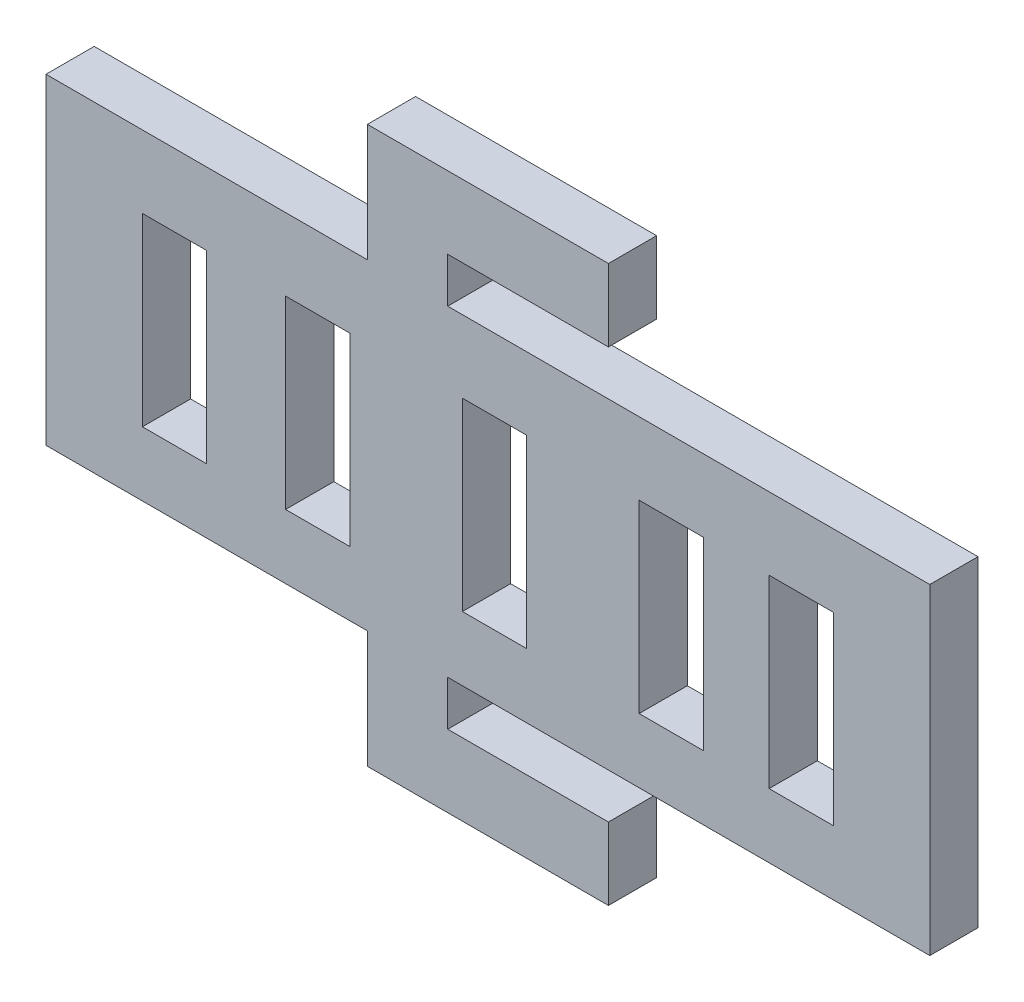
SolidWorks part; units mm, degrees
ref_plane "Alzado" through (0, 0, 0) normal (0, 0, 1) x (1, 0, 0)
ref_plane "Planta" through (0, 0, 0) normal (0, 1, 0) x (1, 0, 0)
ref_plane "Vista lateral" through (0, 0, 0) normal (1, 0, 0) x (0, 0, -1)
sketch "Sketch1" plane through (0, 0, 0) normal (0, 0, 1) x (1, 0, 0)
  line L0 (-7.5, -10) -> (-7.5, -17.3)
  line L1 (-27.5, -10) -> (27.5, -10)
  line L2 (-27.5, -10) -> (-27.5, 10)
  line L3 (-27.5, 10) -> (27.5, 10)
  line L4 (27.5, -10) -> (27.5, 10)
  line L5 (-27.5, -10) -> (27.5, 10) construction
  line L6 (-27.5, 10) -> (27.5, -10) construction
  line L7 (-7.5, -17.3) -> (7.5, -17.3)
  line L8 (7.5, -17.3) -> (7.5, -12.8)
  line L9 (7.5, -12.8) -> (-2.5, -12.8)
  line L10 (-2.5, -12.8) -> (-2.5, -10)
  line L11 (-7.5, 10) -> (-7.5, 17.3)
  line L12 (-7.5, 17.3) -> (7.5, 17.3)
  line L13 (7.5, 17.3) -> (7.5, 12.8)
  line L14 (7.5, 12.8) -> (-2.5, 12.8)
  line L15 (-2.5, 12.8) -> (-2.5, 10)
  line L17 (-17.5, -6) -> (-21.5, -6)
  line L18 (-17.5, -6) -> (-17.5, 5.5)
  line L19 (-17.5, 5.5) -> (-21.5, 5.5)
  line L20 (-21.5, -6) -> (-21.5, 5.5)
  line L21 (-17.5, -6) -> (-21.5, 5.5) construction
  line L22 (-17.5, 5.5) -> (-21.5, -6) construction
  line L23 (-12.5879, 5.5) -> (-8.5879, 5.5)
  line L24 (-12.5879, 5.5) -> (-12.5879, -6)
  line L25 (-12.5879, -6) -> (-8.5879, -6)
  line L26 (-8.5879, 5.5) -> (-8.5879, -6)
  line L27 (-1.5879, 5.5) -> (2.4121, 5.5)
  line L28 (-1.5879, 5.5) -> (-1.5879, -6)
  line L29 (-1.5879, -6) -> (2.4121, -6)
  line L30 (2.4121, 5.5) -> (2.4121, -6)
  line L31 (9.4121, 5.5) -> (13.4121, 5.5)
  line L32 (9.4121, 5.5) -> (9.4121, -6)
  line L33 (9.4121, -6) -> (13.4121, -6)
  line L34 (13.4121, 5.5) -> (13.4121, -6)
  line L35 (17.5, 5.5) -> (21.5, 5.5)
  line L36 (17.5, 5.5) -> (17.5, -6)
  line L37 (17.5, -6) -> (21.5, -6)
  line L38 (21.5, 5.5) -> (21.5, -6)
  point P0 (0, 0)
  point P14 (-19.5, -0.25)
  dimension "D1" = 20
  dimension "D2" = 55
  dimension "D3" = 20
  dimension "D4" = 7.3
  dimension "D5" = 15
  dimension "D6" = 4.5
  dimension "D7" = 10
  dimension "D8" = 7.3
  dimension "D9" = 15
  dimension "D10" = 4.5
  dimension "D11" = 10
  dimension "D12" = 4.5
  dimension "D13" = 11.5
  dimension "D14" = 4
  dimension "D15" = 6
  dimension "D16" = 6
  dimension "D17" = 4.5
  dimension "D18" = 4
  dimension "D19" = 4
  dimension "D20" = 4
  dimension "D21" = 4
  dimension "D22" = 7
  dimension "D23" = 7
  dimension "D24" = 18.9121
  dimension "D25" = 15.5
  dimension "D26" = 4
  dimension "D27" = 4
  dimension "D28" = 4
  dimension "D29" = 4
  dimension "D30" = 15.5
  dimension "D31" = 4.5
extrude "Boss-Extrude1" add sketch "Sketch1" along normal blind 3 contours L1 L4 L3 L2 L17 L20 L19 L18 L23 L26 L25 L24 L27 L30 L29 L28 L31 L34 L33 L32 L35 L38 L37 L36 | L15 L14 L13 L12 L11 L3 | L9 L10 L1 L0 L7 L8
